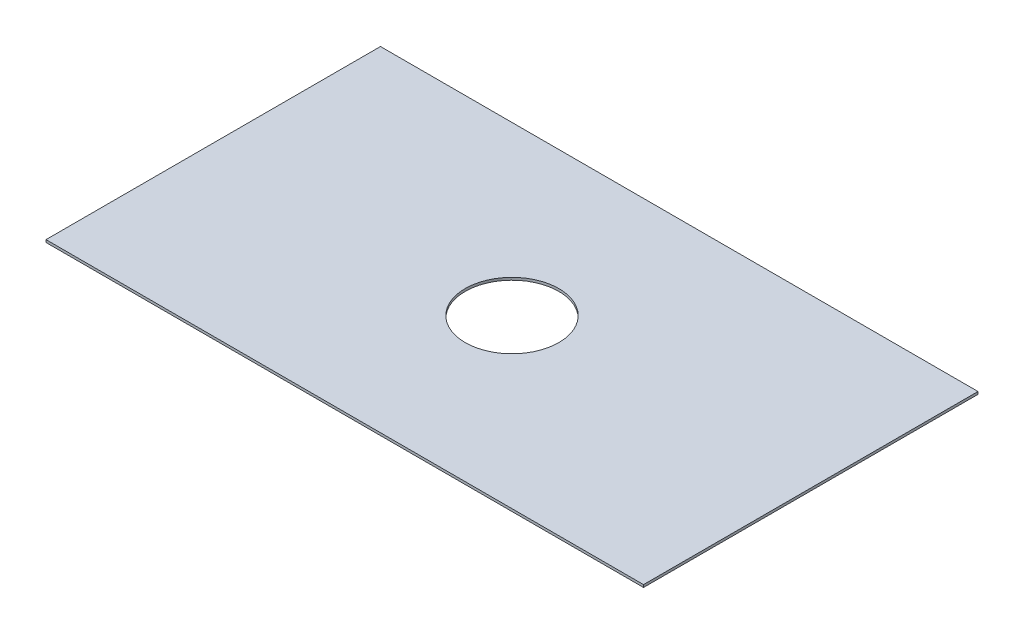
SolidWorks part; units mm, degrees
ref_plane "Plan de face" through (0, 0, 0) normal (0, 0, 1) x (1, 0, 0)
ref_plane "Plan de dessus" through (0, 0, 0) normal (0, 1, 0) x (1, 0, 0)
ref_plane "Plan de droite" through (0, 0, 0) normal (1, 0, 0) x (0, 0, -1)
sketch "Esquisse1" plane through (0, 0, 0) normal (0, 1, 0) x (1, 0, 0)
  line L0 (-178.65, 100) -> (178.65, -100) construction
  line L1 (-178.65, 100) -> (178.65, 100)
  line L2 (-178.65, 100) -> (-178.65, -100)
  line L3 (-178.65, -100) -> (178.65, -100)
  line L4 (178.65, 100) -> (178.65, -100)
  circle A0 centre (0, 0) radius 28
  dimension "D3" = 56
  dimension "D1" = 200
  dimension "D2" = 357.3
sheet metal parameters "Tôlerie 1" thickness 1.5 parameters "D1"=0.7366, "Epaisseur"=1.5
base flange "Tôle de base pliée1" sketch "Esquisse1" thickness 1.5 reverse thickness direction yes parameters "D1"=0.7366
flat pattern "Etat déplié1"
sketch "Lignes de pliage1" plane through (0, 0, 0) normal (0, 1, 0) x (-1, 0, 0)
